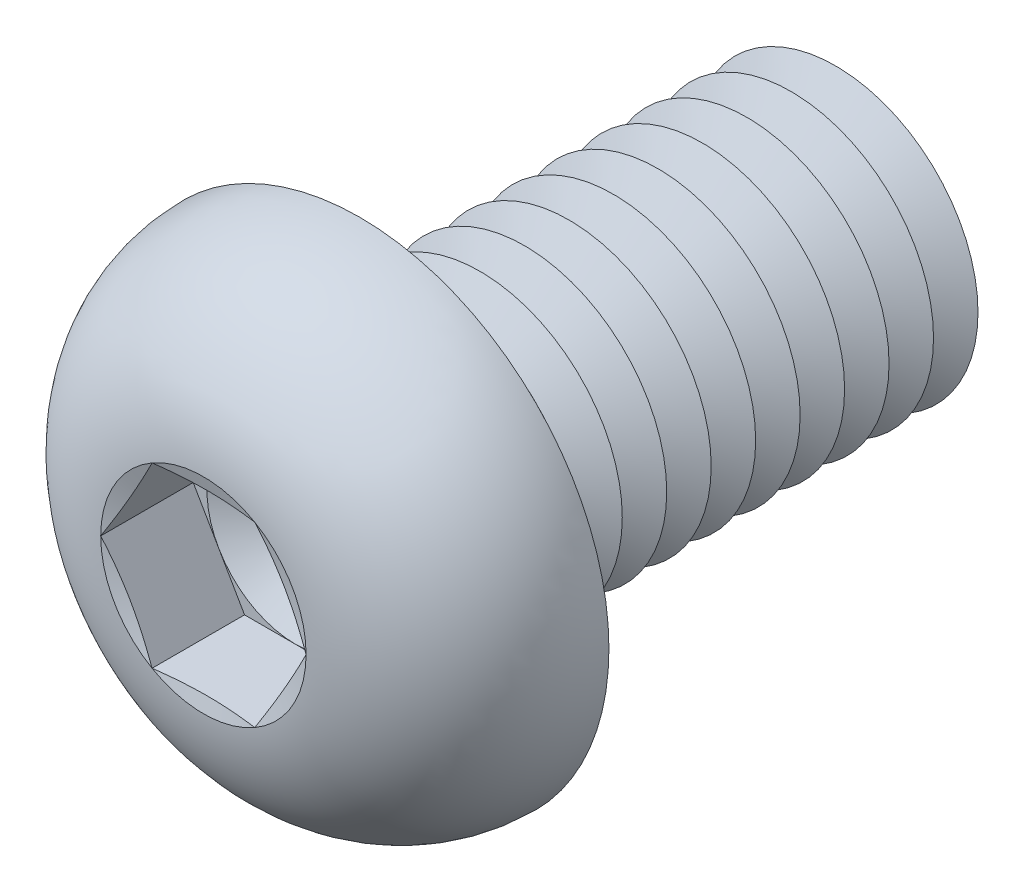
SolidWorks part; units mm, degrees
ref_plane "Front Plane" through (0, 0, 0) normal (0, 0, 1) x (1, 0, 0)
ref_plane "Top Plane" through (0, 0, 0) normal (0, 1, 0) x (1, 0, 0)
ref_plane "Right Plane" through (0, 0, 0) normal (1, 0, 0) x (0, 0, -1)
sketch "Sketch1" plane through (0, 0, 0) normal (1, 0, 0) x (0, 0, -1)
  line L0 (0, 4) -> (0, 7)
  line L3 (0, 4) -> (14, 4)
  line L4 (14, 4) -> (14, 0)
  line L5 (14, 0) -> (-4.4, 0) construction
  line L6 (-4.4, 0) -> (14, 0)
  line L7 (-4.4, 2.8867) -> (-4.4, 1.4434) construction
  line L8 (-4.4, 1.4434) -> (-4.4, 0)
  line L9 (-4.4, 2.8867) -> (-4.0132, 1.4434)
  line L10 (-4.0132, 1.4434) -> (-4.4, 1.4434)
  line L11 (14, 0) -> (22.7481, 0) construction
  line L12 (0, 7) -> (-4.4, 7) construction
  arc A1 (0, 7) -> (-4.4, 2.8867) centre (0, 2.59) ccw
  point P8 (14, 2)
  dimension "D1" = 14
  dimension "D2" = 8
  dimension "D3" = 4.4
  dimension "D4" = 5.7735
  dimension "D5" = 14
  dimension "D6" = 15
revolve "Revolve1" add sketch "Sketch1" angle 360 about L5
fillet "Fillet1" radius 0.625 1 edges at (-4, 0, 0)
sketch "Sketch2" plane through (0, 0, 0) normal (1, 0, 0) x (0, 0, -1)
  line L0 (13.375, 4) -> (14.625, 4)
  line L1 (14, 4) -> (0.625, 4) construction
  line L2 (14.625, 4) -> (14, 2.9175)
  line L3 (14, -4) -> (14, 4) construction
  line L4 (14, 2.9175) -> (13.375, 4)
  dimension "D1" = 1.25
revolve "Cut-Revolve1" cut sketch "Sketch2" angle 360 about axis through (0, 0, -14) along (0, 0, -1)
pattern_linear "LPattern1" count 11 spacing 1.25 along (0, 0, 1) of "Cut-Revolve1"
sketch "Sketch3" plane through (0, 0, 4.4) normal (0, 0, 1) x (1, 0, 0)
  line L7 (1.4434, 2.5) -> (-1.4434, 2.5)
  line L8 (-1.4434, 2.5) -> (-2.8867, 0)
  line L9 (-2.8867, 0) -> (-1.4434, -2.5)
  line L10 (-1.4434, -2.5) -> (1.4434, -2.5)
  line L11 (1.4434, -2.5) -> (2.8867, 0)
  line L12 (2.8867, 0) -> (1.4434, 2.5)
  circle A0 centre (0, 0) radius 2.5 construction
  circle A3 centre (0, 0) radius 2.8867 construction
extrude "Cut-Extrude1" cut sketch "Sketch3" against normal blind 2.6
sketch "Sketch4" plane through (0, 0, 1.8) normal (0, 0, 1) x (1, 0, 0)
  line L1 (1.4434, 2.5) -> (-1.4434, 2.5) construction
  circle A0 centre (0, 0) radius 2.5
extrude "Cut-Extrude2" cut sketch "Sketch4" against normal through all draft 60
